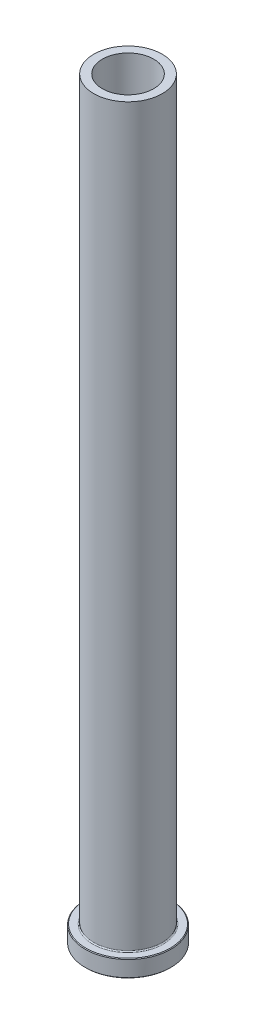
SolidWorks part; units mm, degrees
ref_plane "Front Plane" through (0, 0, 0) normal (0, 0, 1) x (1, 0, 0)
ref_plane "Top Plane" through (0, 0, 0) normal (0, 1, 0) x (1, 0, 0)
ref_plane "Right Plane" through (0, 0, 0) normal (1, 0, 0) x (0, 0, -1)
sketch "Sketch1" plane through (0, 0, 0) normal (0, 0, 1) x (1, 0, 0)
  line L0 (0, 0) -> (0, 50000) construction
  line L1 (0, 0) -> (15.875, 0)
  line L2 (15.875, 0) -> (15.875, 6.35)
  line L3 (15.875, 6.35) -> (13.0905, 6.35)
  line L4 (12.6936, 6.7469) -> (12.6936, 279.4)
  line L5 (12.6936, 279.4) -> (0, 279.4)
  line L6 (0, 279.4) -> (0, 0)
  arc A0 (12.6936, 6.7469) -> (13.0905, 6.35) centre (13.0905, 6.7469) ccw
  dimension "D5" = 0.3969
  dimension "D1" = 25.3873
  dimension "D2" = 31.75
  dimension "D3" = 6.35
  dimension "D4" = 279.4
revolve "Revolve1" add sketch "Sketch1" angle 360 about L0
sketch "Sketch2" plane through (0, 0, 0) normal (0, 0, 1) x (1, 0, 0)
  line L0 (0, 0) -> (0, 50000) construction
  line L1 (-15.875, 0) -> (15.875, 0) construction
  line L2 (10.1124, 0) -> (9.7155, 0.3969)
  line L3 (9.7155, 0.3969) -> (9.7155, 204.9145)
  line L4 (9.7155, 204.9145) -> (9.525, 219.202)
  line L5 (9.525, 219.202) -> (9.525, 279.4)
  line L6 (12.6936, 279.4) -> (-12.6936, 279.4) construction
  line L7 (9.525, 279.4) -> (0, 279.4)
  line L8 (0, 279.4) -> (0, 0)
  line L9 (0, 0) -> (10.1124, 0)
  point P4 (0, 0)
  dimension "D1" = 0.3969
  dimension "D2" = 45
  dimension "D3" = 19.05
  dimension "D4" = 19.431
  dimension "D5" = 60.198
  dimension "D6" = 14.2875
revolve "Cut-Revolve1" cut sketch "Sketch2" angle 360 about L0
chamfer "Chamfer1" distance 0.254 angle 45 2 edges at (0, 0, -15.875) (0, 6.35, -15.875)
